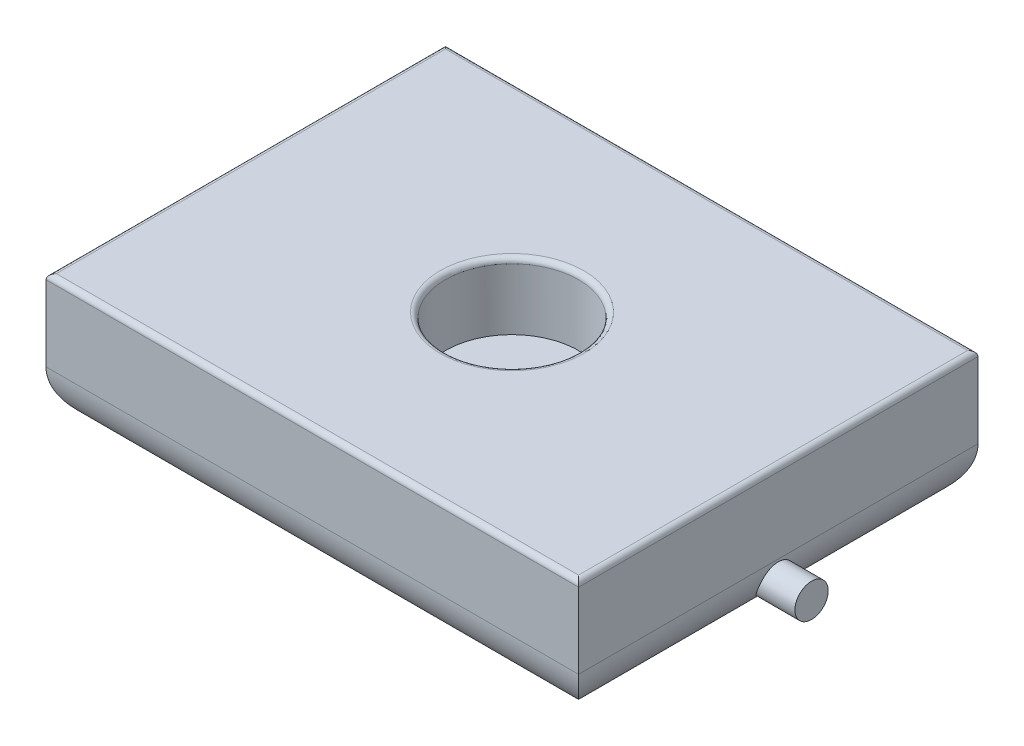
SolidWorks part; units mm, degrees
ref_plane "Front Plane" through (0, 0, 0) normal (0, 0, 1) x (1, 0, 0)
ref_plane "Top Plane" through (0, 0, 0) normal (0, 1, 0) x (1, 0, 0)
ref_plane "Right Plane" through (0, 0, 0) normal (1, 0, 0) x (0, 0, -1)
sketch "Sketch1" plane through (0, 0, 0) normal (0, 1, 0) x (1, 0, 0)
  line L1 (-50.8, -38.1) -> (50.8, -38.1)
  line L2 (-50.8, -38.1) -> (-50.8, 38.1)
  line L3 (-50.8, 38.1) -> (50.8, 38.1)
  line L4 (50.8, -38.1) -> (50.8, 38.1)
  point P4 (-50.8, 0)
  point P6 (0, -38.1)
  dimension "D1" = 101.6
  dimension "D2" = 76.2
extrude "Boss-Extrude1" add sketch "Sketch1" along normal blind 25.4
sketch "Sketch2" plane through (0, 25.4, 0) normal (0, 1, 0) x (1, 0, 0)
  circle A0 centre (0, 0) radius 12.7
  dimension "D1" = 25.4
extrude "Cut-Extrude1" cut sketch "Sketch2" against normal blind 12.7
sketch "Sketch3" plane through (50.8, 0, 0) normal (1, 0, 0) x (0, 0, -1)
  line L0 (0, 0) -> (0, 6.35)
  circle A0 centre (0, 6.35) radius 3.175
  dimension "D2" = 6.35
  dimension "D1" = 6.35
extrude "Boss-Extrude2" add sketch "Sketch3" along normal blind 6.35
mirror "Mirror1" about plane through (0, 0, 0) normal (1, 0, 0) of "Boss-Extrude2"
fillet "Fillet1" radius 10 4 edges at (0, 0, 38.1) (50.8, 0, 0) (0, 0, -38.1) (-50.8, 0, 0)
fillet "Fillet3" radius 1 5 edges at (0, 25.4, -38.1) (50.8, 25.4, 0) (0, 25.4, 38.1) (-50.8, 25.4, 0) (0, 25.4, 12.7)
